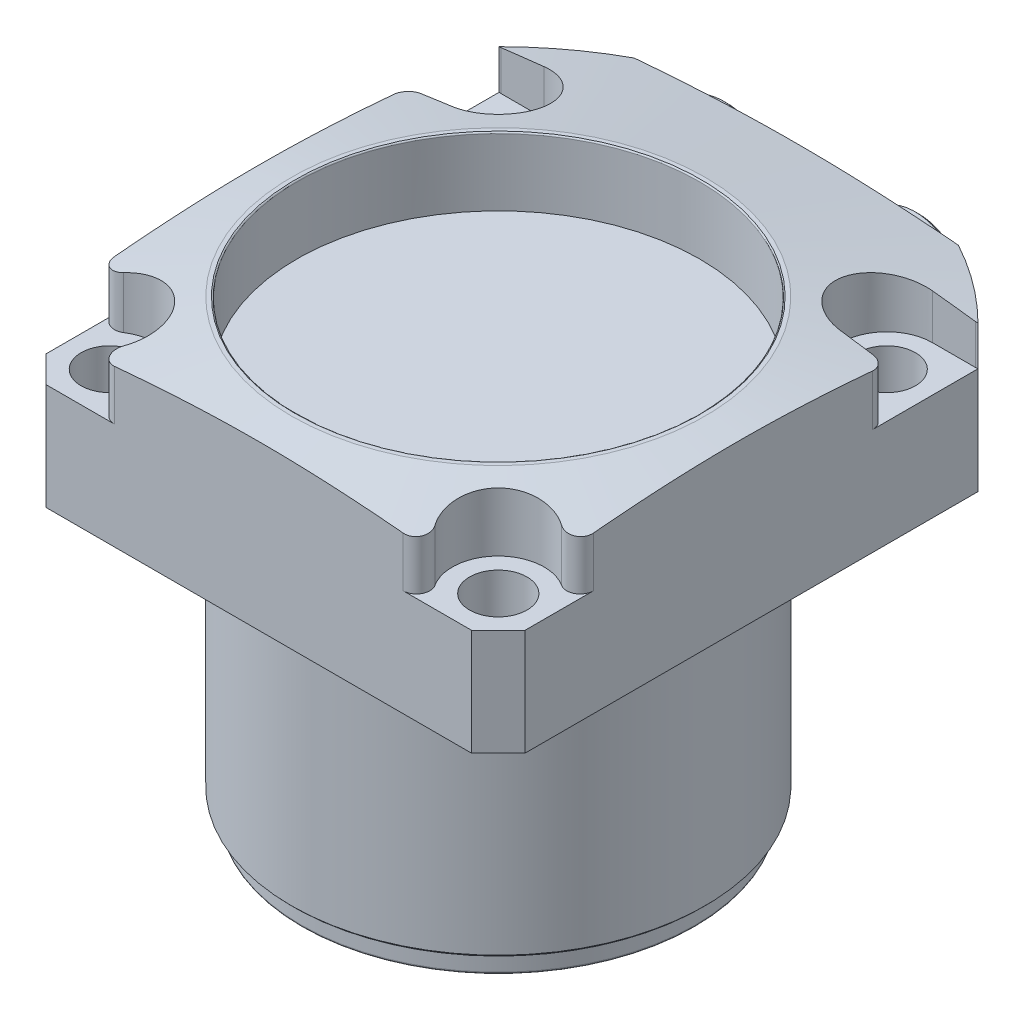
SolidWorks part; units mm, degrees
ref_plane "Front Plane" through (0, 0, 0) normal (0, 0, 1) x (1, 0, 0)
ref_plane "Top Plane" through (0, 0, 0) normal (0, 1, 0) x (1, 0, 0)
ref_plane "Right Plane" through (0, 0, 0) normal (1, 0, 0) x (0, 0, -1)
sketch "Sketch6" plane through (0, 0, 0) normal (0, 0, 1) x (1, 0, 0)
  line L0 (0, -8.9689) -> (0, 71.3762) construction
  line L1 (37.875, 31.81) -> (38.875, 31.81)
  line L2 (38.875, 31.81) -> (63.75, 27.4239)
  line L3 (63.75, 27.4239) -> (63.75, 0)
  line L4 (63.75, 0) -> (38.885, 0)
  line L5 (38.885, 0) -> (38.885, -48.38)
  line L6 (38.885, -48.38) -> (0, -48.38)
  line L7 (0, -48.38) -> (0, 19)
  line L8 (37.875, 31.81) -> (37.875, 19)
  line L9 (37.875, 19) -> (0, 19)
  dimension "D1" = 77.77
  dimension "D2" = 31.81
  dimension "D3" = 48.38
  dimension "D4" = 127.5
  dimension "D5" = 10
  dimension "D6" = 77.75
  dimension "D7" = 12.81
  dimension "D8" = 75.75
revolve "Revolve3" add sketch "Sketch6" angle 360 about L0
fillet "Fillet7" radius 0.25 1 edges at (0, 31.81, -37.875)
sketch "Sketch7" plane through (0, 0, 0) normal (0, -1, 0) x (1, 0, 0)
  line L0 (0, 0) -> (0, -52.3237) construction
  line L1 (-45, 45) -> (45, 45)
  line L2 (-45, 45) -> (-45, -56)
  line L3 (-45, -56) -> (45, -56)
  line L4 (45, 45) -> (45, -56)
  dimension "D1" = 90
  dimension "D2" = 101
  dimension "D3" = 45
extrude "Cut-Extrude5" cut sketch "Sketch7" against normal through all flip side to cut
sketch "Sketch8" plane through (0, 0, 0) normal (0, -1, 0) x (1, 0, 0)
  circle A0 centre (-36.5, 36.5) radius 5.4
  dimension "D1" = 10.8
  dimension "D2" = 36.5
  dimension "D3" = 36.5
extrude "Cut-Extrude6" cut sketch "Sketch8" against normal through all
pattern_circular "CirPattern2" count 4 over 360 about axis through (0, 0, 0) along (0, 1, 0) of "Cut-Extrude6"
chamfer "Chamfer1" distance 5 angle 45 2 edges at (-45, 13.7217, 45) (45, 13.7217, 45)
sketch "Sketch9" plane through (0, 31.81, 0) normal (0, 1, 0) x (1, 0, 0)
  line L0 (-45, -40) -> (-40, -45) construction
  line L1 (-40, -45) -> (40, -45) construction
  line L2 (45, 45.125) -> (45, 27.875)
  line L3 (-45, -40) -> (-40, -45)
  line L4 (45, 27.875) -> (36.5, 27.875)
  line L5 (36.5, 45.125) -> (45, 45.125)
  line L6 (-36.5, 45.125) -> (-45, 45.125)
  line L7 (-45, 45.156) -> (-45, -40) construction
  line L8 (-45, 27.875) -> (-36.5, 27.875)
  line L9 (-45, 45.125) -> (-45, 27.875)
  line L10 (-40, -45) -> (-32.8024, -45)
  line L11 (0, 0) -> (0, 26.6366) construction
  line L13 (-45, -32.8024) -> (-42.5988, -30.4012)
  line L14 (-30.4012, -42.5988) -> (-32.8024, -45)
  line L15 (-45, -32.8024) -> (-45, -40)
  line L16 (45, -32.8024) -> (45, -40)
  line L17 (30.4012, -42.5988) -> (32.8024, -45)
  line L18 (45, -32.8024) -> (42.5988, -30.4012)
  line L19 (40, -45) -> (32.8024, -45)
  line L20 (45, -40) -> (40, -45)
  arc A0 (-30.4012, -42.5988) -> (-42.5988, -30.4012) centre (-36.5, -36.5) ccw
  arc A1 (-36.5, 27.875) -> (-36.5, 45.125) centre (-36.5, 36.5) ccw
  arc A2 (30.4012, -42.5988) -> (42.5988, -30.4012) centre (36.5, -36.5) cw
  arc A3 (36.5, 27.875) -> (36.5, 45.125) centre (36.5, 36.5) cw
  dimension "D1" = 17.25
extrude "Cut-Extrude7" cut sketch "Sketch9" against normal offset from surface (11.81 mm away) 20
fillet "Fillet4" radius 2.5 8 edges at (-45, 24.6655, -27.875) (45, 23.7139, -45.125) (45, 24.6655, -27.875) (45, 24.4228, 32.8024) (32.8024, 24.4228, 45) (-32.8024, 24.4228, 45) (-45, 24.4228, 32.8024) (-45, 23.7139, -45.125)
fillet "Fillet5" radius 0.4 1 edges at (0, 0, -38.885)
sketch "Sketch17" plane through (0, 0, 0) normal (0, 0, 1) x (1, 0, 0)
  line L0 (0, 0) -> (0, -34.4902) construction
  line L1 (-38.885, -48.38) -> (38.885, -48.38) construction
  line L2 (-36.6, -48.38) -> (0, -48.38)
  line L3 (-37, -48.78) -> (-37, -51.98)
  line L4 (-36.6, -52.38) -> (0, -52.38)
  line L5 (0, -48.38) -> (0, -52.38)
  arc A0 (-37, -51.98) -> (-36.6, -52.38) centre (-36.6, -51.98) ccw
  arc A1 (-36.6, -48.38) -> (-37, -48.78) centre (-36.6, -48.78) ccw
  point P11 (-37, -52.38)
  point P14 (-37, -48.38)
  dimension "D3" = 0.4
  dimension "D1" = 4
  dimension "D2" = 74
revolve "Revolve8" add sketch "Sketch17" angle 360 about L0
chamfer "Chamfer2" distance 0.5 angle 45 1 edges at (0, -48.38, -38.885)
ref_plane "Plane1" through (0, 15, 0) normal (0, -1, 0) x (1, 0, 0)
sketch "Sketch11" plane through (0, 15, 0) normal (0, -1, 0) x (1, 0, 0)
  line L0 (-18, -4.7006) -> (-18, -58.3255) construction
  line L1 (-30.4641, -56) -> (30.4641, -56) construction
  line L10 (-18, -56) -> (-28.75, -56)
  line L11 (-18, -37.03) -> (-18, -56)
  line L12 (-23.945, -37.03) -> (-18, -37.03)
  line L13 (-23.945, -55.045) -> (-23.945, -37.03)
  line L14 (-24.65, -55.75) -> (-23.945, -55.045)
  line L15 (-28.75, -55.75) -> (-24.65, -55.75)
  line L16 (-28.75, -56) -> (-28.75, -55.75)
  dimension "D1" = 18
  dimension "D2" = 0.25
  dimension "D3" = 18.72
  dimension "D4" = 11.89
  dimension "D5" = 21.5
  dimension "D6" = 45
  dimension "D7" = 0.705
revolve "Cut-Revolve5" cut sketch "Sketch11" angle 360 about L0
ref_plane "Plane2" through (0, 0, -46) normal (0, 0, 1) x (1, 0, 0)
sketch "Sketch13" plane through (0, 0, -46) normal (0, 0, 1) x (1, 0, 0)
  line L0 (-22.375, 12.25) -> (-22.375, 3)
  line L1 (-22.375, 3) -> (-23.125, 2.25)
  line L2 (-23.125, 2.25) -> (-25, 2.25)
  line L3 (-25, 2.25) -> (-25, 0)
  line L4 (-39.285, 0) -> (39.285, 0) construction
  line L5 (-25, 0) -> (-18, 0)
  line L6 (-18, 0) -> (-18, 12.25)
  line L7 (-18, 12.25) -> (-22.375, 12.25)
  line L8 (-18, 15.2099) -> (-18, -4.3918) construction
  dimension "D1" = 18
  dimension "D2" = 8.75
  dimension "D3" = 12.25
  dimension "D4" = 2.25
  dimension "D5" = 14
  dimension "D6" = 45
  dimension "D7" = 0.75
revolve "Cut-Revolve6" cut sketch "Sketch13" angle 360 about L8
sketch "Sketch14" plane through (0, 15, 0) normal (0, -1, 0) x (1, 0, 0)
  line L0 (-18, -46) -> (-18, 43.3353) construction
  line L14 (-23.6, -53.2474) -> (-23.6, -55.75)
  line L15 (-23.6, -55.75) -> (-27.5, -55.75)
  line L16 (-27.5, -55.75) -> (-27.5, -61.05)
  line L17 (-27.5, -61.05) -> (-21, -61.05)
  line L18 (-21, -61.05) -> (-21, -55.051)
  line L19 (-21, -55.051) -> (-18, -53.2484)
  line L20 (-18, -53.2484) -> (-18, -53.2474)
  line L21 (-18, -53.2474) -> (-23.6, -53.2474)
  line L22 (-28.75, -55.75) -> (-7.25, -55.75) construction
  dimension "D12" = 19
  dimension "D13" = 5.3
  dimension "D14" = 6
  dimension "D15" = 11.2
  dimension "D16" = 2.5026
  dimension "D17" = 59
  dimension "D18" = 0.001
revolve "Revolve6" add sketch "Sketch14" angle 360 about L0
chamfer "Chamfer3" distance 0.4 angle 45 1 edges at (-21, 15, -61.05)
chamfer "Chamfer4" distance 0.75 angle 45 1 edges at (-27.5, 15, -61.05)
sketch "Sketch15" plane through (0, 0, -61.05) normal (0, 0, 1) x (1, 0, 0)
  line L1 (-15, 13.2679) -> (-15, 16.7321)
  line L2 (-15, 16.7321) -> (-18, 18.4641)
  line L3 (-18, 18.4641) -> (-21, 16.7321)
  line L4 (-21, 16.7321) -> (-21, 13.2679)
  line L5 (-21, 13.2679) -> (-18, 11.5359)
  line L6 (-18, 11.5359) -> (-15, 13.2679)
  circle A0 centre (-18, 15) radius 3 construction
  circle A1 centre (-18, 15) radius 3 construction
  dimension "D1" = 6
extrude "Cut-Extrude8" cut sketch "Sketch15" along normal blind 6
mirror "Mirror4" about plane through (0, 0, 0) normal (1, 0, 0) of "Chamfer4", "Chamfer3", "Cut-Revolve5", "Cut-Revolve6", "Revolve6", "Cut-Extrude8"
sketch "Sketch16" plane through (0, 0, -46) normal (0, 0, 1) x (1, 0, 0)
  line L1 (-18, 9.3219) -> (-18, -15.1063) construction
  line L2 (-18, 3) -> (-18, 10.9748) construction
  line L3 (40, 0) -> (-40, 0) construction
  circle A0 centre (-23.5, 0.75) radius 1.5
  dimension "D1" = 3
  dimension "D3" = 0.75
  dimension "D2" = 11
revolve "Revolve7" add sketch "Sketch16" angle 360 about L1
mirror "Mirror3" about plane through (0, 0, 0) normal (1, 0, 0)
